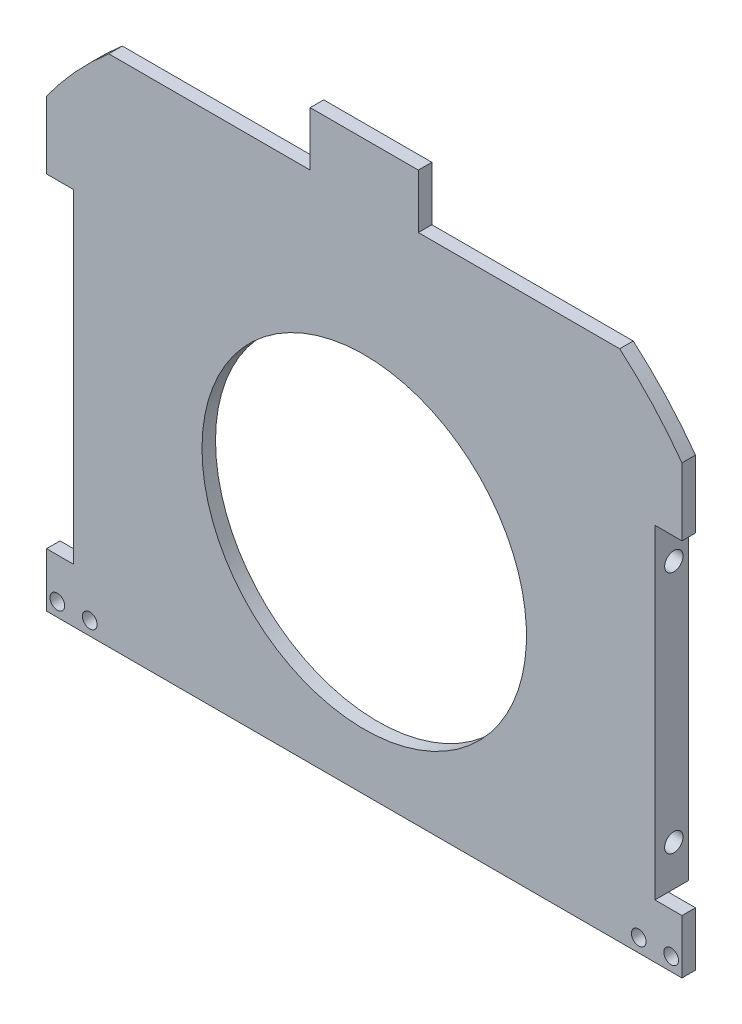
SolidWorks part; units mm, degrees
ref_plane "Front" through (0, 0, 0) normal (0, 0, 1) x (1, 0, 0)
ref_plane "Top" through (0, 0, 0) normal (0, 1, 0) x (1, 0, 0)
ref_plane "Right" through (0, 0, 0) normal (1, 0, 0) x (0, 0, -1)
sketch "Sketch1" plane through (0, 0, 0) normal (0, 0, 1) x (1, 0, 0)
  line L1 (-66.675, -57.15) -> (-66.675, -63.5) construction
  line L2 (76.2, 25.4) -> (76.2, -50.8)
  line L3 (69.85, -63.5) -> (82.55, -63.5) construction
  line L4 (-66.675, -50.8) -> (-66.675, -63.5)
  line L5 (76.2, -50.8) -> (82.55, -50.8) construction
  line L6 (-66.675, -50.8) -> (-60.325, -50.8) construction
  line L7 (-60.325, -50.8) -> (-66.675, -50.8)
  line L9 (-66.675, -63.5) -> (82.55, -63.5)
  line L10 (-60.325, 25.4) -> (-60.325, -50.8)
  line L14 (67.9274, 57.15) -> (-52.0524, 57.15) construction
  line L15 (67.9274, 57.15) -> (20.6375, 57.15)
  line L16 (-4.7625, 69.85) -> (20.6375, 69.85) construction
  line L17 (-4.7625, 69.85) -> (20.6375, 69.85)
  line L18 (20.6375, 69.85) -> (20.6375, 57.15)
  line L19 (-4.7625, 69.85) -> (-4.7625, 57.15)
  line L20 (-4.7625, 57.15) -> (-52.0524, 57.15)
  line L21 (82.55, 41.2516) -> (82.55, -66.6516) construction
  line L22 (-66.675, -66.6516) -> (-66.675, 41.2516) construction
  line L23 (82.55, 25.4) -> (76.2, 25.4) construction
  line L24 (-60.325, 25.4) -> (-66.675, 25.4) construction
  line L26 (-66.675, 25.4) -> (-66.675, 41.2516)
  line L27 (76.2, 25.4) -> (82.55, 25.4)
  line L28 (-66.675, 25.4) -> (-60.325, 25.4)
  line L29 (82.55, -50.8) -> (76.2, -50.8)
  line L31 (82.55, 41.2516) -> (82.55, 25.4)
  line L32 (82.55, -50.8) -> (82.55, -63.5)
  circle A0 centre (-64.135, -60.3033) radius 1.7272
  circle A1 centre (-56.515, -60.3033) radius 1.7272
  circle A2 centre (80.01, -60.3467) radius 1.7272
  circle A3 centre (72.39, -60.3467) radius 1.7272
  arc A6 (-52.0524, 57.15) -> (-61.9125, 47.2899) centre (7.9375, -12.7) ccw construction
  arc A7 (77.7875, 47.2899) -> (67.9274, 57.15) centre (7.9375, -12.7) ccw construction
  arc A10 (-52.0524, 57.15) -> (-66.675, 41.2516) centre (7.9375, -12.7) ccw
  arc A11 (82.55, 41.2516) -> (67.9274, 57.15) centre (7.9375, -12.7) ccw
  dimension "D1" = 3.4544
  dimension "D2" = 3.4544
  dimension "D3" = 3.4544
  dimension "D4" = 3.4544
  dimension "D5" = 12.7
  dimension "D6" = 76.2
  dimension "D7" = 6.35
  dimension "D8" = 6.35
extrude "Base-Extrude" add sketch "Sketch1" along normal blind 3.175
sketch "Sketch2" plane through (0, 0, 0) normal (0, 0, -1) x (-1, 0, 0)
  line L0 (-82.55, -50.8) -> (-76.2, -50.8) construction
  line L1 (60.325, 25.4) -> (55.5625, 25.4)
  line L2 (60.325, 25.4) -> (60.325, -50.8)
  line L3 (60.325, -50.8) -> (55.5625, -50.8)
  line L4 (55.5625, 25.4) -> (55.5625, -50.8)
  line L5 (-76.2, 25.4) -> (-71.4375, 25.4)
  line L6 (-76.2, 25.4) -> (-76.2, -50.8)
  line L7 (-76.2, -50.8) -> (-71.4375, -50.8)
  line L8 (-71.4375, 25.4) -> (-71.4375, -50.8)
  line L9 (60.325, -50.8) -> (66.675, -50.8) construction
  line L10 (66.675, 25.4) -> (60.325, 25.4) construction
  line L11 (60.325, 25.4) -> (60.325, -50.8) construction
  dimension "D1" = 4.7625
  dimension "D2" = 4.7625
extrude "Boss-Extrude1" add sketch "Sketch2" along normal blind 4.7625
sketch "Sketch3" plane through (0, 0, 0) normal (0, 0, -1) x (-1, 0, 0)
  line L0 (-7.9375, 69.85) -> (-7.9375, -58.5366) construction
  line L1 (-20.6375, 69.85) -> (4.7625, 69.85) construction
  line L2 (-76.2, -12.1424) -> (74.9092, -12.1424) construction
  circle A0 centre (-7.9375, -12.1424) radius 38.1
  dimension "D1" = 76.2
extrude "big hole" cut sketch "Sketch3" against normal through all
sketch "Sketch4" plane through (-60.325, 0, 0) normal (-1, 0, 0) x (0, 0, 1)
  circle A0 centre (-1.27, 15.875) radius 2.159
  circle A1 centre (-1.27, -41.275) radius 2.159
  dimension "D1" = 4.318
  dimension "D2" = 4.318
extrude "Cut-Extrude2" cut sketch "Sketch4" against normal blind 6.35
sketch "Sketch5" plane through (76.2, 0, 0) normal (1, 0, 0) x (0, 0, -1)
  circle A0 centre (1.27, -41.275) radius 2.159
  circle A1 centre (1.27, 15.875) radius 2.159
  dimension "D1" = 4.318
  dimension "D2" = 4.318
extrude "Cut-Extrude3" cut sketch "Sketch5" against normal blind 6.35
